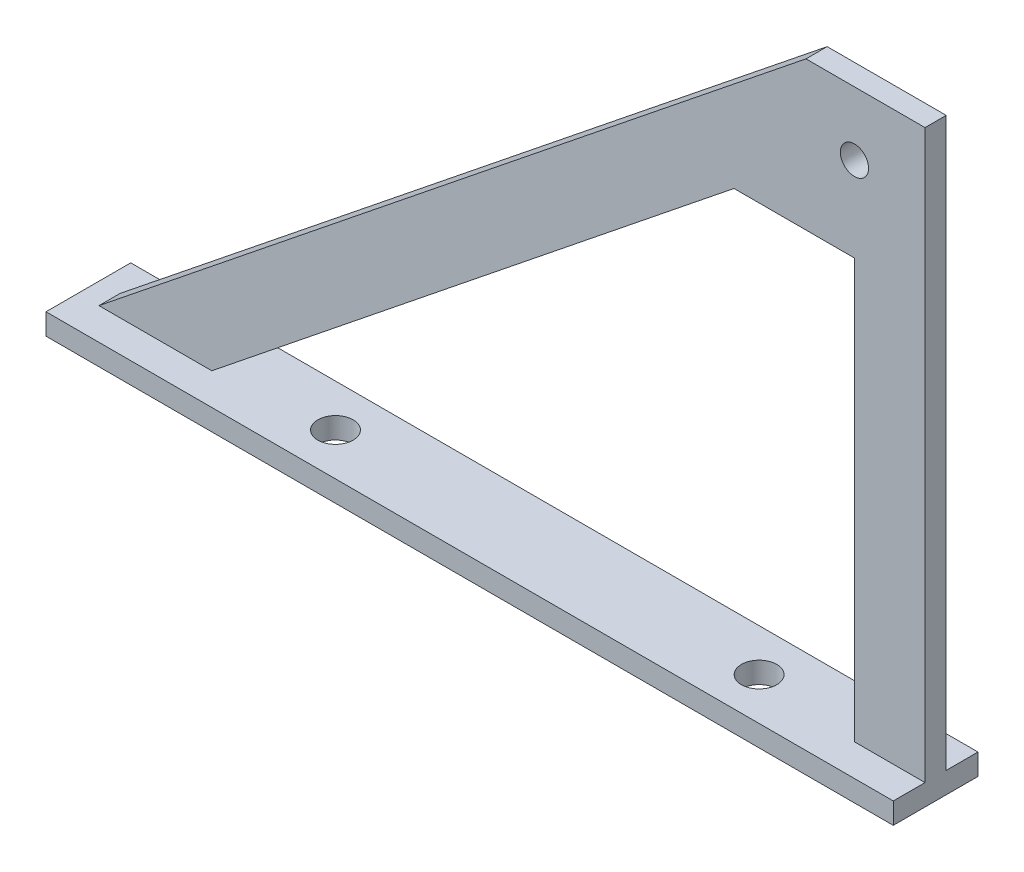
SolidWorks part; units mm, degrees
ref_plane "Front Plane" through (0, 0, 0) normal (0, 0, 1) x (1, 0, 0)
ref_plane "Top Plane" through (0, 0, 0) normal (0, 1, 0) x (1, 0, 0)
ref_plane "Right Plane" through (0, 0, 0) normal (1, 0, 0) x (0, 0, -1)
sketch "Sketch1" plane through (0, 0, 0) normal (0, 1, 0) x (1, 0, 0)
  line L0 (-60, -50) -> (-60, -62)
  line L1 (-60, 62) -> (60, 62)
  line L2 (-60, 62) -> (-60, 50)
  line L3 (-60, -62) -> (60, -62)
  line L4 (60, 62) -> (60, 50)
  line L6 (60, -50) -> (60, -62)
  line L7 (-60, 50) -> (60, 50)
  line L9 (-60, -50) -> (60, -50)
  point P0 (0, 0)
  point P6 (0, 0)
  dimension "D1" = 120
  dimension "D2" = 12
  dimension "D3" = 124
extrude "Boss-Extrude1" add sketch "Sketch1" along normal blind 3
sketch "Sketch2" plane through (0, 0, 62) normal (0, 0, 1) x (1, 0, 0)
  line L0 (-57, 3) -> (60, 96.8669)
  line L1 (-60, 3) -> (60, 3) construction
  line L2 (60, 96.8669) -> (60, 3)
  line L3 (60, 3) -> (50, 3)
  line L4 (50, 3) -> (50, 76.0236)
  line L5 (50, 76.0236) -> (-41.0199, 3)
  line L6 (-41.0199, 3) -> (-57, 3)
  dimension "D1" = 10
  dimension "D2" = 3
  dimension "D3" = 10
  dimension "D4" = 150
extrude "Boss-Extrude2" add sketch "Sketch2" along normal blind 3 from offset 7.5
sketch "Sketch3" plane through (0, 0, -50) normal (0, 0, 1) x (1, 0, 0)
  line L6 (60, 96.8669) -> (-57, 3)
  line L7 (60, 3) -> (60, 96.8669)
  line L8 (50, 3) -> (60, 3)
  line L9 (50, 76.0236) -> (50, 3)
  line L10 (-41.0199, 3) -> (50, 76.0236)
  line L11 (-57, 3) -> (-41.0199, 3)
  line L12 (60, 96.8669) -> (-57, 3)
  line L13 (60, 3) -> (60, 96.8669)
  line L14 (50, 3) -> (60, 3)
  line L15 (50, 76.0236) -> (50, 3)
  line L16 (-41.0199, 3) -> (50, 76.0236)
  line L17 (-57, 3) -> (-41.0199, 3)
  dimension "D1" = 0
extrude "Boss-Extrude3" add sketch "Sketch3" along normal blind 3 from offset 7.5
sketch "Sketch4" plane through (0, 3, 0) normal (0, 1, 0) x (1, 0, 0)
  line L0 (-60, -50) -> (-60, -62) construction
  line L1 (60, -62) -> (60, -57.5) construction
  line L2 (60, 50) -> (60, 54.5) construction
  line L3 (-60, 62) -> (-60, 50) construction
  line L4 (-60, 50) -> (60, 50) construction
  circle A0 centre (-25, 56) radius 2.5
  circle A1 centre (35, 56) radius 2.5
  circle A2 centre (-25, -56) radius 2.5
  circle A3 centre (35, -56) radius 2.5
  dimension "D1" = 5
  dimension "D2" = 5
  dimension "D5" = 5
  dimension "D6" = 5
  dimension "D3" = 35
  dimension "D4" = 25
  dimension "D7" = 25
  dimension "D8" = 35
extrude "Cut-Extrude1" cut sketch "Sketch4" against normal blind 7
sketch "Sketch5" plane through (0, 0, 57.5) normal (0, 0, 1) x (1, 0, 0)
  line L0 (32.9429, 62.339) -> (50, 62.339)
  line L1 (-41.0199, 3) -> (50, 76.0236) construction
  line L2 (50, 76.0236) -> (50, 3) construction
  line L3 (50, 83.6703) -> (32.9429, 69.9858)
  line L4 (32.9429, 69.9858) -> (32.9429, 62.339)
  line L5 (50, 83.6703) -> (55.4894, 76.828)
  line L6 (55.4894, 76.828) -> (55.4894, 62.339)
  line L7 (55.4894, 62.339) -> (50, 62.339)
extrude "Boss-Extrude4" add sketch "Sketch5" against normal blind 3
sketch "Sketch6" plane through (0, 0, -54.5) normal (0, 0, 1) x (1, 0, 0)
  line L6 (32.9429, 62.339) -> (50, 62.339)
  line L7 (50, 62.339) -> (55.4894, 62.339)
  line L8 (55.4894, 62.339) -> (55.4894, 76.828)
  line L9 (55.4894, 76.828) -> (50, 83.6703)
  line L10 (50, 83.6703) -> (32.9429, 69.9858)
  line L11 (32.9429, 69.9858) -> (32.9429, 62.339)
  line L12 (32.9429, 62.339) -> (50, 62.339)
  line L13 (50, 62.339) -> (55.4894, 62.339)
  line L14 (55.4894, 62.339) -> (55.4894, 76.828)
  line L15 (55.4894, 76.828) -> (50, 83.6703)
  line L16 (50, 83.6703) -> (32.9429, 69.9858)
  line L17 (32.9429, 69.9858) -> (32.9429, 62.339)
  dimension "D1" = 0
extrude "Boss-Extrude5" add sketch "Sketch6" against normal blind 3
sketch "Sketch7" plane through (0, 0, 57.5) normal (0, 0, 1) x (1, 0, 0)
  line L0 (60, 3) -> (60, 96.8669) construction
  line L1 (32.9429, 62.339) -> (50, 62.339) construction
  circle A0 centre (50, 74.339) radius 2
  dimension "D1" = 4
  dimension "D2" = 10
  dimension "D3" = 12
extrude "Cut-Extrude2" cut sketch "Sketch7" against normal blind 120
sketch "Sketch8" plane through (0, 0, 57.5) normal (0, 0, 1) x (1, 0, 0)
  line L0 (60, 83.339) -> (43.1382, 83.339)
  line L1 (60, 3) -> (60, 96.8669) construction
  line L2 (60, 96.8669) -> (-57, 3) construction
  line L3 (43.1382, 83.339) -> (60, 96.8669)
  line L4 (60, 96.8669) -> (60, 83.339)
  line L5 (32.9429, 62.339) -> (50, 62.339) construction
  dimension "D1" = 21
extrude "Cut-Extrude3" cut sketch "Sketch8" against normal blind 120
sketch "Sketch9" plane through (0, 0, 62) normal (0, 0, 1) x (1, 0, 0)
  line L1 (-65.9524, 86.6435) -> (65.9524, 86.6435)
  line L2 (-65.9524, 86.6435) -> (-65.9524, -22.3671)
  line L3 (-65.9524, -22.3671) -> (65.9524, -22.3671)
  line L4 (65.9524, 86.6435) -> (65.9524, -22.3671)
  line L5 (-65.9524, 86.6435) -> (65.9524, -22.3671) construction
  line L6 (-65.9524, -22.3671) -> (65.9524, 86.6435) construction
  point P0 (0, 32.1382)
extrude "Cut-Extrude4" cut sketch "Sketch9" against normal blind 20
